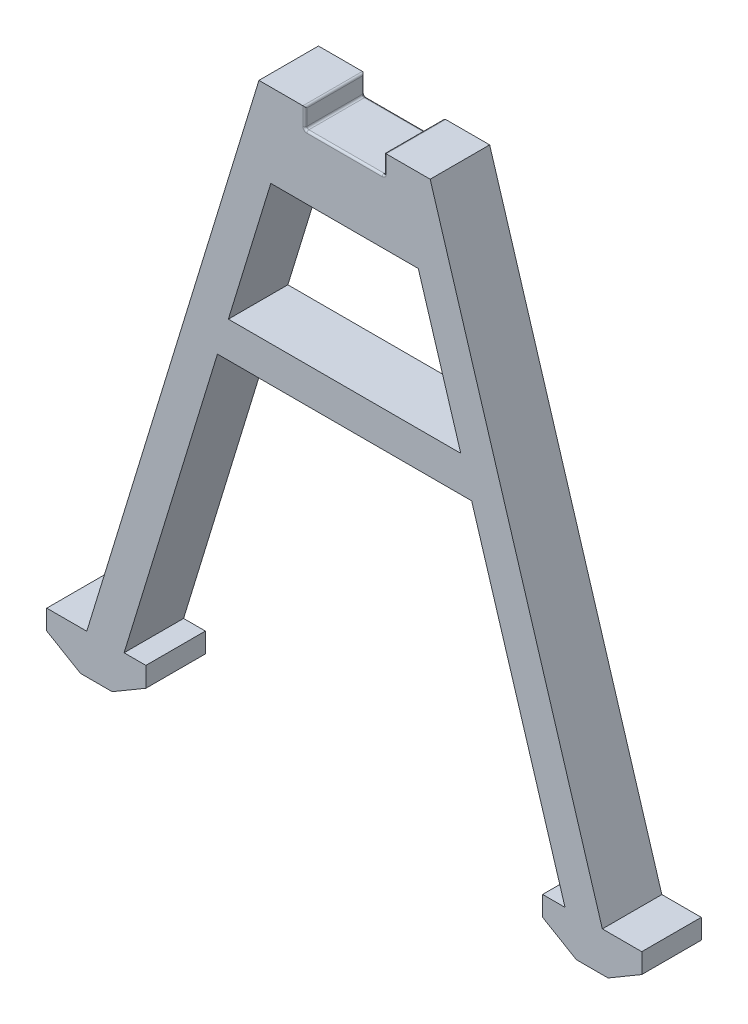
SolidWorks part; units mm, degrees
ref_plane "Front Plane" through (0, 0, 0) normal (0, 0, 1) x (1, 0, 0)
ref_plane "Top Plane" through (0, 0, 0) normal (0, 1, 0) x (1, 0, 0)
ref_plane "Right Plane" through (0, 0, 0) normal (1, 0, 0) x (0, 0, -1)
other "Center of Mass"
sketch "Sketch1" plane through (0, 0, 0) normal (0, 1, 0) x (1, 0, 0)
  line L1 (-80, 22.5) -> (80, 22.5)
  line L2 (-80, 22.5) -> (-80, -22.5)
  line L3 (-80, -22.5) -> (80, -22.5)
  line L4 (80, 22.5) -> (80, -22.5)
  line L5 (-80, 22.5) -> (80, -22.5) construction
  line L6 (-80, -22.5) -> (80, 22.5) construction
  point P0 (0, 0)
  dimension "D1" = 45
  dimension "D2" = 160
extrude "Boss-Extrude1" add sketch "Sketch1" along normal blind 15
sketch "Sketch2" plane through (0, 0, 0) normal (0, 0, 1) x (1, 0, 0)
  line L5 (0, 0) -> (0, 1352.7514) construction
  line L6 (-65, 15) -> (-21.5862, 157)
  line L7 (-80, 15) -> (80, 15) construction
  line L8 (-21.5862, 157) -> (21.5862, 157)
  line L9 (21.5862, 157) -> (65, 15)
  line L10 (65, 15) -> (-65, 15)
  line L11 (-80, 0) -> (80, 0) construction
  dimension "D1" = 15
  dimension "D2" = 15
  dimension "D3" = 73
  dimension "D4" = 73
  dimension "D5" = 157
extrude "Boss-Extrude2" add sketch "Sketch2" along normal mid plane 15
sketch "Sketch3" plane through (0, 0, 7.5) normal (0, 0, 1) x (1, 0, 0)
  line L8 (-55.5888, 15) -> (55.5888, 15)
  line L13 (55.5888, 15) -> (32.0475, 92)
  line L14 (32.0475, 92) -> (-32.0475, 92)
  line L15 (-32.0475, 92) -> (-55.5888, 15)
  line L16 (-21.5862, 157) -> (-65, 15) construction
  line L17 (65, 15) -> (21.5862, 157) construction
  line L18 (-80, 15) -> (80, 15) construction
  line L19 (-29.2959, 101) -> (29.2959, 101)
  line L20 (29.2959, 101) -> (18.5954, 136)
  line L21 (18.5954, 136) -> (-18.5954, 136)
  line L22 (-18.5954, 136) -> (-29.2959, 101)
  line L23 (21.5862, 157) -> (-21.5862, 157) construction
  line L29 (-10, 162) -> (10, 162)
  line L30 (-10, 162) -> (-10, 152)
  line L31 (-10, 152) -> (10, 152)
  line L32 (10, 162) -> (10, 152)
  line L33 (-10, 162) -> (10, 152) construction
  line L34 (-10, 152) -> (10, 162) construction
  point P16 (0, 157)
  dimension "D1" = 9
  dimension "D2" = 9
  dimension "D3" = 0
  dimension "D4" = 9
  dimension "D5" = 77
  dimension "D6" = 5
  dimension "D7" = 20
  dimension "D8" = 35
extrude "Cut-Extrude1" cut sketch "Sketch3" against normal through all
fillet "Fillet1" radius 0.5 10 edges at (10, 154.5, -7.5) (10, 154.5, 7.5) (-10, 154.5, -7.5) (-10, 154.5, 7.5) (-10, 157, 0) (10, 157, 0) (10, 152, 0) (-10, 152, 0) (0, 152, 7.5) (0, 152, -7.5)
fillet "Fillet2" [suppressed] radius 0.5
sketch "Sketch4" plane through (0, 15, 0) normal (0, 1, 0) x (1, 0, 0)
  line L14 (-41.5, 30) -> (41.5, 30)
  line L15 (-41.5, 30) -> (-41.5, -30)
  line L16 (-41.5, -30) -> (41.5, -30)
  line L17 (41.5, 30) -> (41.5, -30)
  line L18 (-41.5, 30) -> (41.5, -30) construction
  line L19 (-41.5, -30) -> (41.5, 30) construction
  point P0 (0, 0)
  dimension "D1" = 83
  dimension "D2" = 60
extrude "Cut-Extrude2" cut sketch "Sketch4" against normal blind 23
sketch "Sketch5" plane through (0, 15, 0) normal (0, 1, 0) x (1, 0, 0)
  line L0 (-21.5862, -7.5) -> (-65, -7.5) construction
  line L1 (-75.0914, 7.5) -> (-50.0914, 7.5)
  line L2 (-75.0914, 7.5) -> (-75.0914, -7.5)
  line L3 (-75.0914, -7.5) -> (-50.0914, -7.5)
  line L4 (-50.0914, 7.5) -> (-50.0914, -7.5)
  line L5 (-75.0914, 7.5) -> (-50.0914, -7.5) construction
  line L6 (-75.0914, -7.5) -> (-50.0914, 7.5) construction
  line L7 (-65, 7.5) -> (-55.5888, 7.5) construction
  line L9 (49.9386, 7.5) -> (74.9386, 7.5)
  line L10 (49.9386, 7.5) -> (49.9386, -7.5)
  line L11 (49.9386, -7.5) -> (74.9386, -7.5)
  line L12 (74.9386, 7.5) -> (74.9386, -7.5)
  line L13 (49.9386, 7.5) -> (74.9386, -7.5) construction
  line L14 (49.9386, -7.5) -> (74.9386, 7.5) construction
  point P0 (-62.5914, 0)
  point P9 (62.4386, 0)
  dimension "D1" = 25
  dimension "D2" = 25
extrude "Cut-Extrude6" cut sketch "Sketch5" against normal through all flip side to cut
sketch "Sketch6" plane through (0, 0, 0) normal (0, -1, 0) x (1, 0, 0)
  line L1 (-75.0914, 7.5) -> (-50.0914, 7.5)
  line L2 (-75.0914, 7.5) -> (-75.0914, -7.5)
  line L3 (-75.0914, -7.5) -> (-50.0914, -7.5)
  line L4 (-50.0914, 7.5) -> (-50.0914, -7.5)
  line L5 (-75.0914, 7.5) -> (-50.0914, -7.5) construction
  line L6 (-75.0914, -7.5) -> (-50.0914, 7.5) construction
  line L7 (49.9386, 7.5) -> (74.9386, 7.5)
  line L8 (49.9386, 7.5) -> (49.9386, -7.5)
  line L9 (49.9386, -7.5) -> (74.9386, -7.5)
  line L10 (74.9386, 7.5) -> (74.9386, -7.5)
  line L11 (49.9386, 7.5) -> (74.9386, -7.5) construction
  line L12 (49.9386, -7.5) -> (74.9386, 7.5) construction
  point P0 (-62.5914, 0)
  point P6 (62.4386, 0)
extrude "Cut-Extrude7" cut sketch "Sketch6" against normal blind 5
sketch "Sketch7" plane through (0, 0, 7.5) normal (0, 0, 1) x (1, 0, 0)
  line L0 (-75.0914, 10) -> (-66.5914, 5)
  line L1 (-75.0914, 5) -> (-75.0914, 15) construction
  line L2 (-50.0914, 5) -> (-75.0914, 5) construction
  line L3 (-50.0914, 10) -> (-50.0914, 5)
  line L4 (-58.5914, 5) -> (-50.0914, 10)
  line L5 (-50.0914, 5) -> (-50.0914, 15) construction
  line L6 (-75.0914, 10) -> (-75.0914, 5)
  line L7 (-75.0914, 5) -> (-66.5914, 5)
  line L8 (-50.0914, 5) -> (-58.5914, 5)
  line L9 (49.9386, 10) -> (58.4386, 5)
  line L10 (49.9386, 5) -> (49.9386, 15) construction
  line L11 (74.9386, 5) -> (49.9386, 5) construction
  line L12 (74.9386, 10) -> (66.4386, 5)
  line L13 (74.9386, 5) -> (74.9386, 15) construction
  line L14 (49.9386, 10) -> (49.9386, 5)
  line L15 (49.9386, 5) -> (58.4386, 5)
  line L16 (74.9386, 10) -> (74.9386, 5)
  line L17 (74.9386, 5) -> (66.4386, 5)
  point P25 (62.4386, 5)
  dimension "D3" = 4
  dimension "D4" = 4
  dimension "D5" = 30.466
extrude "Cut-Extrude8" cut sketch "Sketch7" against normal through all
